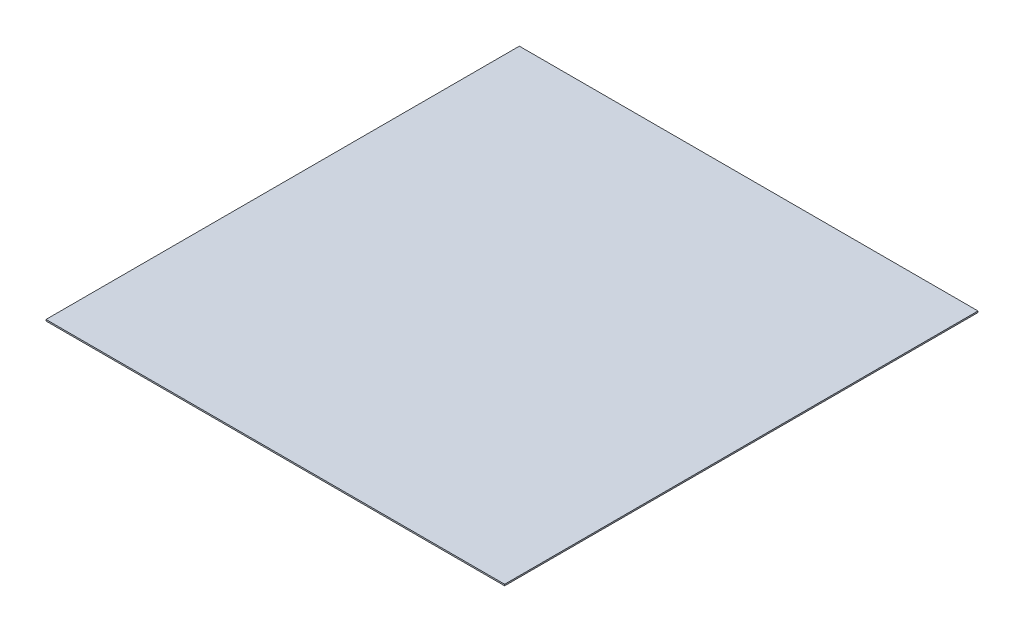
SolidWorks part; units mm, degrees
ref_plane "Front Plane" through (0, 0, 0) normal (0, 0, 1) x (1, 0, 0)
ref_plane "Top Plane" through (0, 0, 0) normal (0, 1, 0) x (1, 0, 0)
ref_plane "Right Plane" through (0, 0, 0) normal (1, 0, 0) x (0, 0, -1)
sketch "Sketch1" plane through (0, 0, 0) normal (0, 1, 0) x (1, 0, 0)
  line L1 (-82.3654, -85.0058) -> (82.3654, -85.0058)
  line L2 (-82.3654, -85.0058) -> (-82.3654, 85.0058)
  line L3 (-82.3654, 85.0058) -> (82.3654, 85.0058)
  line L4 (82.3654, -85.0058) -> (82.3654, 85.0058)
  line L5 (-82.3654, -85.0058) -> (82.3654, 85.0058) construction
  line L6 (-82.3654, 85.0058) -> (82.3654, -85.0058) construction
  point P0 (0, 0)
  point P6 (0, 0)
  point P7 (29.437, -35.1011)
  point P8 (51.9999, -64.7603)
  point P9 (-82.3654, 85.0058)
extrude "Boss-Extrude1" add sketch "Sketch1" along normal blind 0.508
